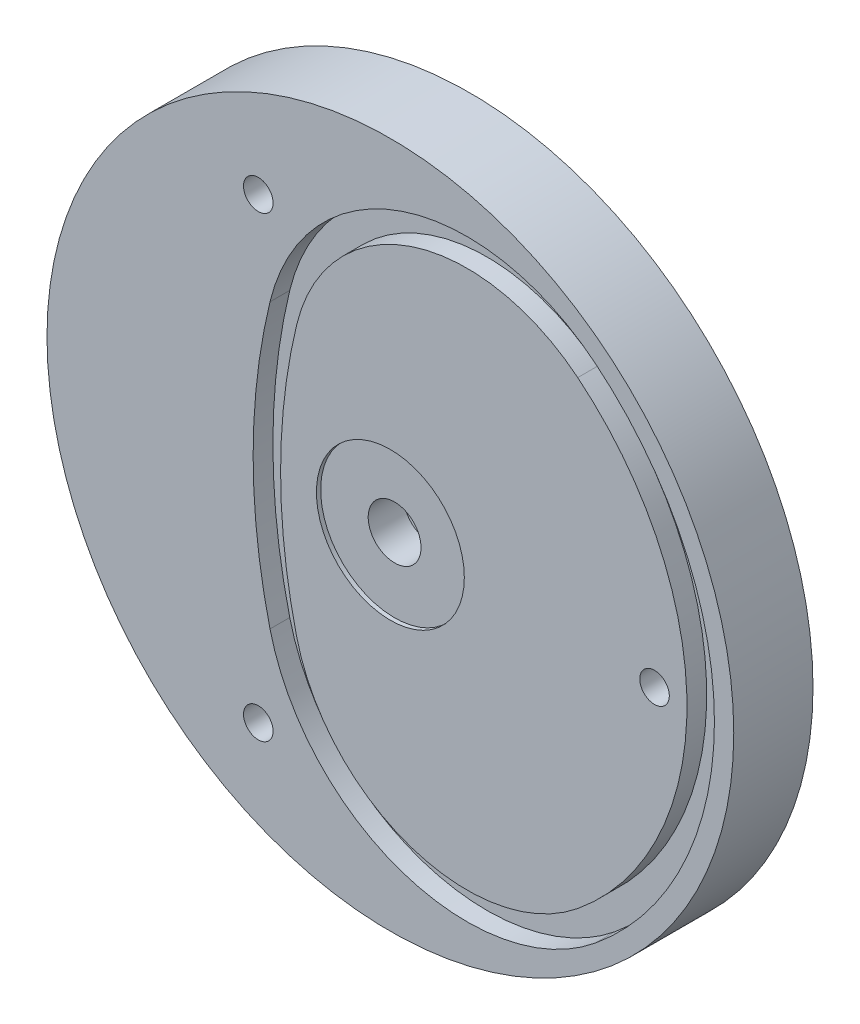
SolidWorks part; units mm, degrees
ref_plane "Plane1" through (0, 0, 0) normal (0, 0, 1) x (1, 0, 0)
ref_plane "Plane2" through (0, 0, 0) normal (0, 1, 0) x (1, 0, 0)
ref_plane "Plane3" through (0, 0, 0) normal (1, 0, 0) x (0, 0, -1)
sketch "Sketch1" plane through (0, 0, 0) normal (0, 0, 1) x (1, 0, 0)
  circle A0 centre (0, 0) radius 82.55
  dimension "D1" = 165.1
extrude "Base-Extrude" add sketch "Sketch1" along normal blind 19.05
sketch "Sketch2" plane through (0, 0, 19.05) normal (0, 0, 1) x (1, 0, 0)
  circle A0 centre (0, 0) radius 17.78
  dimension "D1" = 35.56
extrude "Cut-Extrude1" cut sketch "Sketch2" against normal blind 1.016
sketch "Sketch3" plane through (0, 0, 18.034) normal (0, 0, 1) x (1, 0, 0)
  line L0 (107.5305, 0) -> (-105.8612, 0) construction
  line L1 (0, 85.1341) -> (0, -85.6905) construction
sketch "Sketch4" plane through (0, 0, 0) normal (0, 0, -1) x (-1, 0, 0)
  circle A0 centre (0, 0) radius 10.16
  dimension "D1" = 20.32
extrude "Cut-Extrude2" cut sketch "Sketch4" against normal blind 9.525
sketch "Sketch5" plane through (0, 0, 18.034) normal (0, 0, 1) x (1, 0, 0)
  circle A0 centre (0, 0) radius 6.35
  dimension "D1" = 12.7
extrude "Cut-Extrude3" cut sketch "Sketch5" against normal through all
sketch "Sketch13" plane through (0, 0, 19.05) normal (0, 0, 1) x (1, 0, 0)
  line L0 (107.5305, 0) -> (-105.8612, 0) construction
  circle A0 centre (63.5, 0) radius 3.556
  dimension "D1" = 7.112
  dimension "D2" = 63.5
extrude "Cut-Extrude4" cut sketch "Sketch13" against normal through all
pattern_circular "CirPattern1" count 3 every 120
sketch "Sketch19" plane through (0, 0, 19.05) normal (0, 0, 1) x (1, 0, 0)
  line L0 (-29.6926, 0) -> (-29.6926, -7.4095) construction
  line L2 (74.5998, 0) -> (74.5998, -54.9926) construction
  line L4 (0, 0) -> (120.1614, 0) construction
  line L5 (0, 0) -> (-126.871, 0) construction
  arc A0 (47.1308, 57.8257) -> (-25.7305, 33.2778) centre (18.4292, 22.6111) ccw
  arc A1 (47.1308, 57.8257) -> (74.5998, 0) centre (0, 0) cw
  arc A2 (-29.6926, 0) -> (-25.7305, 33.2778) centre (112.0383, 0) cw
  dimension "D1" = 74.5998
  dimension "D2" = 29.6926
  dimension "D3" = 45.4296
  dimension "D4" = 141.7309
sketch "Sketch20" plane through (0, 0, 0) normal (0, 1, 0) x (1, 0, 0)
  line L0 (71.2978, -19.05) -> (77.9018, -19.05)
  line L1 (77.9018, -19.05) -> (77.9018, -14.3002)
  line L2 (77.9018, -14.3002) -> (71.2978, -14.3002)
  line L3 (71.2978, -14.3002) -> (71.2978, -19.05)
  line L5 (47.1308, -19.05) -> (74.5998, -19.05) construction
  line L9 (0, -114.822) -> (0, 89.1436) construction
  dimension "D1" = 6.604
  dimension "D2" = 4.7498
  dimension "D3" = 3.302
sweep "Cut-Sweep1" cut profiles "Sketch20" path "Sketch19"
mirror "Mirror1" about plane through (0, 0, 0) normal (0, 1, 0)
